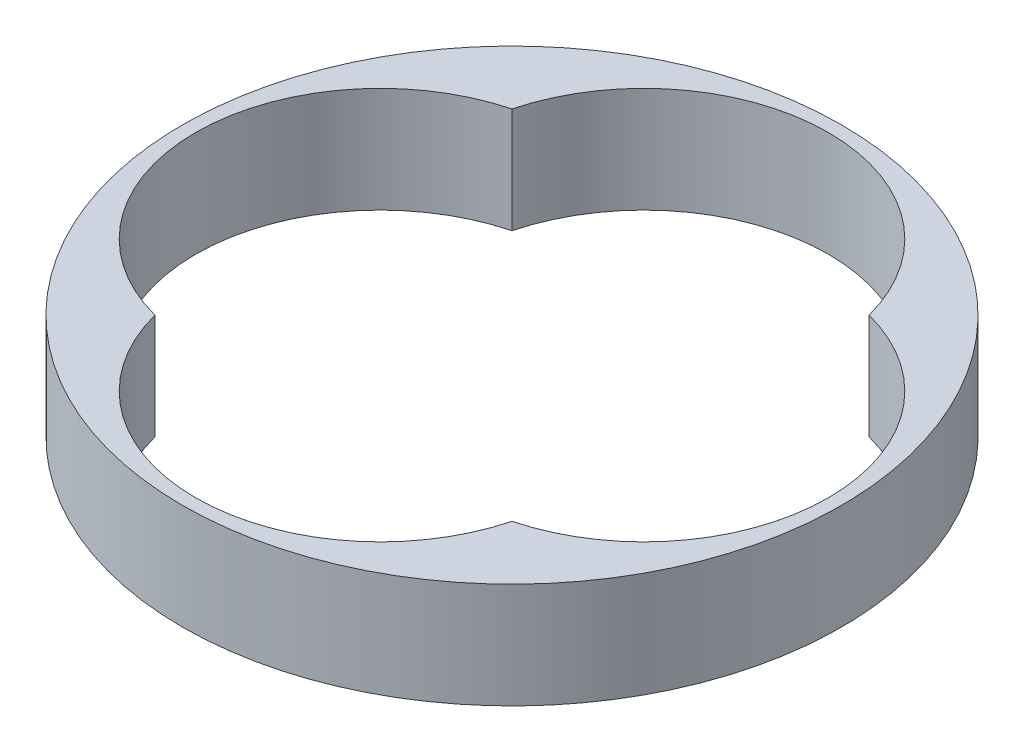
SolidWorks part; units mm, degrees
ref_plane "Front Plane" through (0, 0, 0) normal (0, 0, 1) x (1, 0, 0)
ref_plane "Top Plane" through (0, 0, 0) normal (0, 1, 0) x (1, 0, 0)
ref_plane "Right Plane" through (0, 0, 0) normal (1, 0, 0) x (0, 0, -1)
sketch "Sketch1" plane through (0, 0, 0) normal (0, 1, 0) x (1, 0, 0)
  circle A0 centre (0, 0) radius 62.5
  dimension "D1" = 125
extrude "Boss-Extrude1" add sketch "Sketch1" along normal blind 20
sketch "Sketch2" plane through (0, 20, 0) normal (0, 1, 0) x (1, 0, 0)
  circle A0 centre (0, 0) radius 25
  circle A1 centre (0, 25) radius 35
  circle A2 centre (25, 0) radius 35
  circle A3 centre (0, -25) radius 35
  circle A4 centre (-25, 0) radius 35
  dimension "D1" = 4
extrude "Cut-Extrude1" cut sketch "Sketch2" against normal through all contours A1 | A4 | A3 | A2
